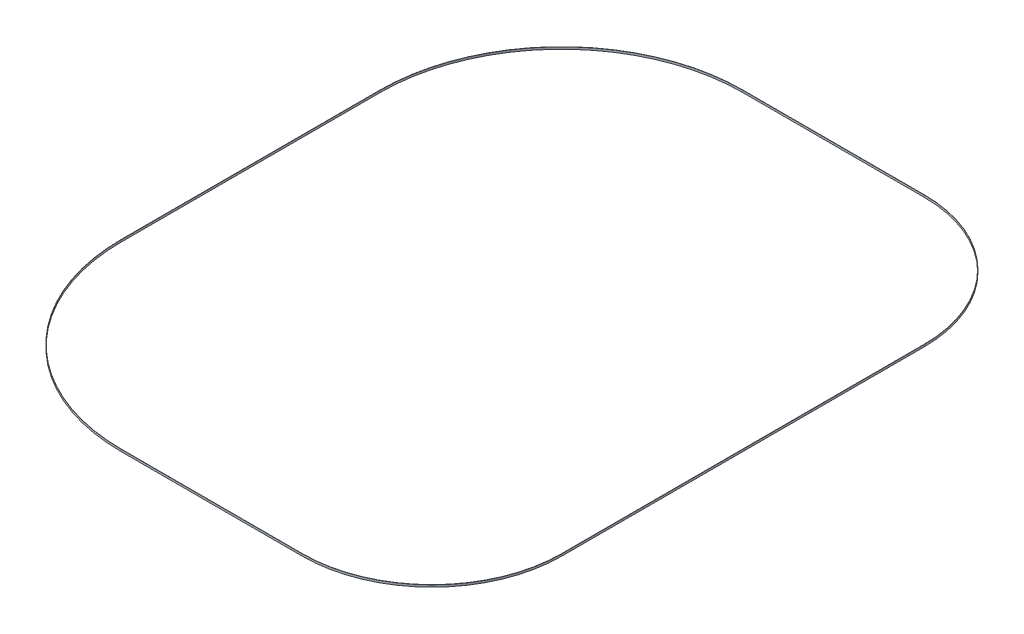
SolidWorks part; units mm, degrees
ref_plane "Vorderseite" through (0, 0, 0) normal (0, 0, 1) x (1, 0, 0)
ref_plane "Oben" through (0, 0, 0) normal (0, 1, 0) x (1, 0, 0)
ref_plane "Rechts" through (0, 0, 0) normal (1, 0, 0) x (0, 0, -1)
ref_plane "Ebene1" through (0, 265, 0) normal (0, 1, 0) x (1, 0, 0)
sketch "Skizze1" plane through (0, 265, 0) normal (0, 1, 0) x (1, 0, 0)
  line L0 (-4000, -3000) -> (-4000, 7000)
  line L1 (3000, 14000) -> (10000, 14000)
  line L2 (15000, 9000) -> (15000, -5000)
  line L3 (10000, -10000) -> (3000, -10000)
  line L4 (0, -50) -> (0, 50) construction
  line L5 (-50, 0) -> (50, 0) construction
  arc A0 (-4000, 7000) -> (3000, 14000) centre (3000, 7000) cw
  arc A1 (10000, 14000) -> (15000, 9000) centre (10000, 9000) cw
  arc A2 (15000, -5000) -> (10000, -10000) centre (10000, -5000) cw
  arc A3 (3000, -10000) -> (-4000, -3000) centre (3000, -3000) cw
  point P20 (-4000, -10000)
  dimension "D6" = 7000
  dimension "D7" = 5000
  dimension "D8" = 5000
  dimension "D9" = 7000
  dimension "D1" = 0
  dimension "D2" = 4000
  dimension "D3" = 15000
  dimension "D4" = 14000
  dimension "D5" = 10000
extrude "Linear-Austragen-Dünn1" add sketch "Skizze1" along normal mid plane 80 thin
